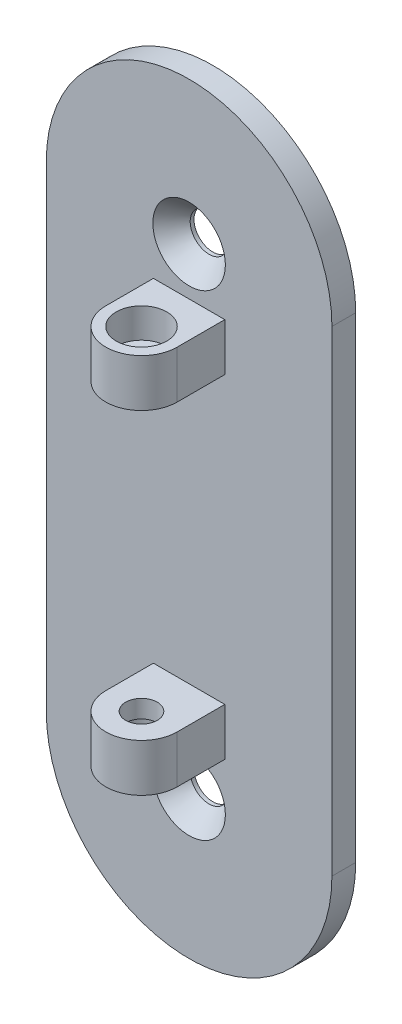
SolidWorks part; units mm, degrees
ref_plane "Front Plane" through (0, 0, 0) normal (0, 0, 1) x (1, 0, 0)
ref_plane "Top Plane" through (0, 0, 0) normal (0, 1, 0) x (1, 0, 0)
ref_plane "Right Plane" through (0, 0, 0) normal (1, 0, 0) x (0, 0, -1)
sketch "Sketch1" plane through (0, 0, 0) normal (0, 0, 1) x (1, 0, 0)
  line L0 (0, 0) -> (0, 63.5)
  line L1 (76.2, 63.5) -> (76.2, 0)
  line L2 (76.2, 0) -> (0, 0)
  arc A0 (0, 63.5) -> (76.2, 63.5) centre (38.1, 63.5) cw
  dimension "D2" = 38.1
  dimension "D1" = 63.5
extrude "Extrude1" add sketch "Sketch1" along normal blind 6.35
hole_wizard "CSK for 3/8 Flat Head Machine Screw1" positions "Sketch3" profile "Sketch2" countersink size "3/8" standard "Ansi Inch"
sketch "Sketch3" plane through (0, 0, 6.35) normal (0, 0, 1) x (1, 0, 0)
  arc A0 (76.2, 63.5) -> (0, 63.5) centre (38.1, 63.5) ccw construction
  point P0 (38.1, 63.5)
sketch "Sketch2" plane through (38.1, 63.5, 6.35) normal (1, 0, 0) x (0, -1, 0)
  line L0 (0, 0) -> (0, 6.35)
  line L1 (0, 6.35) -> (5.0419, 6.35)
  line L2 (5.0419, 6.35) -> (5.0419, 5.3325)
  line L3 (5.0419, 5.3325) -> (9.6774, 0)
  line L5 (9.6774, 0) -> (0, 0)
  line L6 (-5.0419, 5.3325) -> (-9.6774, 0) construction
  line L11 (0, -6.35) -> (0, 107.95) construction
  dimension "Thru Hole Dia." = 10.0838
  dimension "Thru Hole Depth" = 6.35
  dimension "Near C'Sink Dia." = 19.3548
  dimension "Near C'Sink Angle" = 82
sketch "Sketch4" plane through (0, 0, 6.35) normal (0, 0, 1) x (1, 0, 0)
  line L0 (38.1, 0) -> (38.1, 38.1) construction
  line L1 (28.575, 50.8) -> (47.625, 50.8)
  line L2 (28.575, 50.8) -> (28.575, 38.1)
  line L3 (28.575, 38.1) -> (47.625, 38.1)
  line L4 (47.625, 50.8) -> (47.625, 38.1)
  line L5 (0, 0) -> (76.2, 0) construction
  dimension "D1" = 19.05
  dimension "D2" = 12.7
  dimension "D3" = 38.1
extrude "Extrude2" add sketch "Sketch4" along normal blind 12.7
sketch "Sketch8" plane through (0, 50.8, 0) normal (0, 1, 0) x (-1, 0, 0)
  line L0 (-47.625, 19.05) -> (-28.575, 19.05)
  arc A0 (-28.575, 19.05) -> (-47.625, 19.05) centre (-38.1, 19.05) ccw
extrude "Extrude3" add sketch "Sketch8" against normal up to surface (12.7 mm away)
hole_wizard "CBORE for 5/16 Socket Head Cap Screw1" positions "Sketch10" profile "Sketch9" counterbore size "5/16" standard "Ansi Inch"
sketch "Sketch10" plane through (0, 50.8, 0) normal (0, 1, 0) x (-1, 0, 0)
  arc A0 (-28.575, 19.05) -> (-47.625, 19.05) centre (-38.1, 19.05) ccw construction
  point P0 (-38.1, 19.05)
sketch "Sketch9" plane through (38.1, 50.8, 19.05) normal (1, 0, 0) x (0, 0, 1)
  line L0 (0, 0) -> (0, 15.2335)
  line L1 (0, 15.2335) -> (4.2164, 12.7)
  line L2 (4.2164, 12.7) -> (4.2164, 7.9375)
  line L3 (4.2164, 7.9375) -> (6.7475, 7.9375)
  line L4 (6.7475, 7.9375) -> (6.7475, 0)
  line L5 (6.7475, 0) -> (0, 0)
  line L10 (0, 15.2335) -> (-4.2164, 12.7) construction
  line L11 (0, -6.35) -> (0, 107.95) construction
  dimension "Hole Dia." = 8.4328
  dimension "Hole Depth" = 12.7
  dimension "C'Bore Dia." = 13.495
  dimension "C'Bore Depth" = 7.9375
  dimension "Drill Angle" = 118
mirror "Mirror1" about plane through (76.2, 0, 6.35) normal (0, 1, 0)
